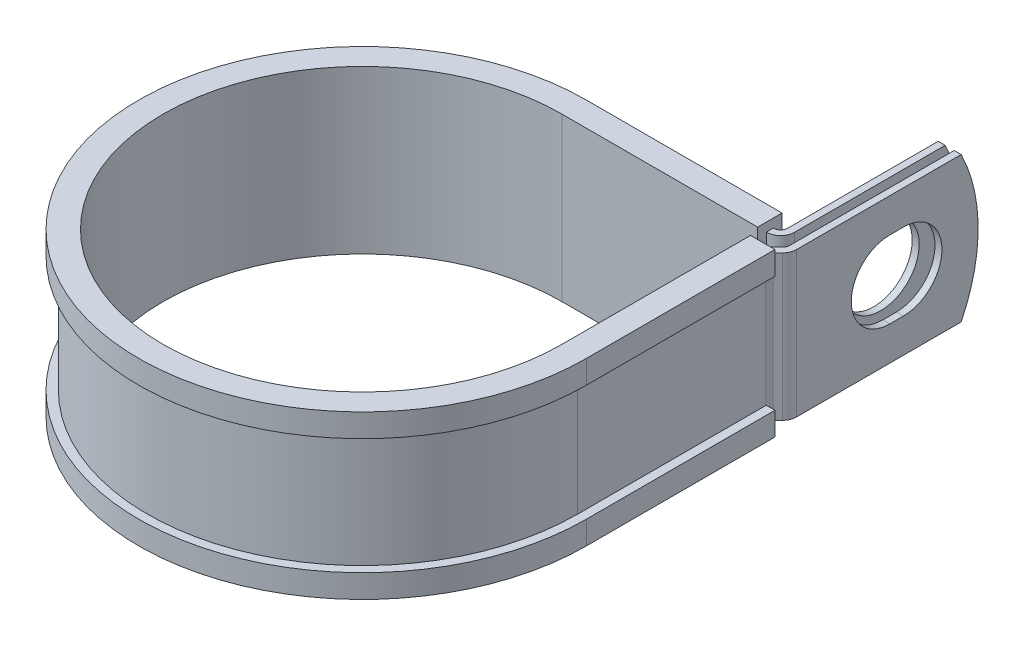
SolidWorks part; units mm, degrees
ref_plane "Front Plane" through (0, 0, 0) normal (0, 0, 1) x (1, 0, 0)
ref_plane "Top Plane" through (0, 0, 0) normal (0, 1, 0) x (1, 0, 0)
ref_plane "Right Plane" through (0, 0, 0) normal (1, 0, 0) x (0, 0, -1)
sketch "Sketch1" plane through (0, 0, 0) normal (0, 1, 0) x (1, 0, 0)
  line L0 (0, 36.449) -> (34.3333, 36.449)
  line L1 (36.449, 0) -> (36.449, 33.0365)
  line L2 (36.7717, 68.2498) -> (36.7717, 38.8874)
  line L3 (37.1632, 34.7607) -> (37.9894, 35.5869)
  line L5 (38.3465, 36.449) -> (38.3465, 68.2498)
  arc A0 (0, 36.449) -> (36.449, 0) centre (0, 0) ccw
  arc A1 (37.1632, 34.7607) -> (36.449, 33.0365) centre (38.8874, 33.0365) ccw
  arc A2 (37.9894, 35.5869) -> (38.3465, 36.449) centre (37.1273, 36.449) ccw
  arc A3 (34.3333, 36.449) -> (36.7717, 38.8874) centre (34.3333, 38.8874) ccw
extrude "Extrude-Thin1" add sketch "Sketch1" along normal mid plane 25.4 thin
sketch "Sketch2" plane through (35.5525, 0, 0) normal (-1, 0, 0) x (0, 0, 1)
  line L0 (-68.2498, 12.7) -> (-68.2498, -12.7) construction
  line L1 (0, 12.7) -> (0, -12.7) construction
  circle A0 centre (-53.975, 0) radius 6.7437
  point P2 (-68.2498, 0)
extrude "Cut-Extrude1" cut sketch "Sketch2" against normal up to surface (1.2192 mm away)
sketch "Sketch3" plane through (39.5657, 0, 0) normal (1, 0, 0) x (0, 0, -1)
  line L0 (52.7812, 0) -> (55.1688, 0) construction
  line L1 (52.7812, 6.7437) -> (55.1688, 6.7437)
  line L2 (52.7812, -6.7437) -> (55.1688, -6.7437)
  line L3 (68.2498, 12.7) -> (68.2498, -12.7) construction
  arc A0 (52.7812, 6.7437) -> (52.7812, -6.7437) centre (52.7812, 0) ccw
  arc A1 (55.1688, -6.7437) -> (55.1688, 6.7437) centre (55.1688, 0) ccw
  point P3 (53.975, 0)
  point P8 (68.2498, 0)
  point P11 (46.0375, 0)
  point P12 (61.9125, 0)
extrude "Cut-Extrude2" cut sketch "Sketch3" against normal up to surface (1.2192 mm away)
sketch "Sketch4" plane through (35.5525, 0, 0) normal (-1, 0, 0) x (0, 0, 1)
  line L0 (-68.2498, 12.7) -> (-68.2498, -12.7)
  line L1 (-68.2498, 12.7) -> (-65.2725, 12.7)
  line L2 (-68.2498, 12.7) -> (-38.8874, 12.7) construction
  line L3 (-68.2498, -12.7) -> (-65.2725, -12.7)
  line L4 (-68.2498, -12.7) -> (-38.8874, -12.7) construction
  arc A0 (-65.2725, 12.7) -> (-65.2725, -12.7) centre (-39.6748, 0) ccw
extrude "Cut-Extrude3" cut sketch "Sketch4" against normal through all contours A0 M4 M5 | A0 L0 M2
ref_plane "Plane1" through (0, 0, -33.0365) normal (0, 0, -1) x (-1, 0, 0)
ref_plane "Plane2" through (34.2825, 0, 0) normal (-1, 0, 0) x (0, 0, 1)
sketch "Sketch5" plane through (0, 0, -33.0365) normal (0, 0, -1) x (-1, 0, 0)
  line L0 (-37.6682, 12.7) -> (-36.449, 12.7)
  line L1 (-37.6682, 12.7) -> (-37.6682, -12.7) construction
  line L3 (-36.449, 12.7) -> (-36.449, -12.7)
  line L4 (-36.449, -12.7) -> (-37.6682, -12.7)
  line L5 (-37.6682, -12.7) -> (-37.6682, -10.16)
  line L6 (-37.6682, 12.7) -> (-37.6682, 10.16)
  line L7 (-39.1922, 14.224) -> (-39.1922, 10.16)
  line L8 (-39.1922, 14.224) -> (-34.925, 14.224)
  line L9 (-34.925, 14.224) -> (-34.925, -14.224)
  line L10 (-34.925, -14.224) -> (-39.1922, -14.224)
  line L11 (-39.1922, -14.224) -> (-39.1922, -10.16)
  line L12 (-39.1922, 10.16) -> (-37.6682, 10.16)
  line L13 (-37.6682, -10.16) -> (-39.1922, -10.16)
sketch "Sketch6" plane through (0, 12.7, 0) normal (0, 1, 0) x (1, 0, 0)
  line L0 (34.925, 0) -> (34.925, 33.0365)
  line L1 (34.925, 33.0365) -> (39.1922, 33.0365) construction
  line L2 (34.2825, 6.9878) -> (34.2825, -6.9878) construction
  line L5 (0, 34.925) -> (34.2825, 34.925)
  arc A0 (0, 34.925) -> (34.925, 0) centre (0, 0) ccw
sweep "Sweep1" add profiles "Sketch5" path "Sketch6"
equation "\"D4@Sketch5\" = \"D1@Extrude-Thin1\""
equation "\"D5@Sketch5\" = \"D5@Extrude-Thin1\""
equation "\"D1@Sketch3\" = \"D2@Sketch2\""
equation "\"D7@Sketch1\" = \"D3@Sketch2\" + \"D1@Sketch3\""
equation "\"D1@Sketch1\" = \"D1@Sketch6\" + 2 * \"D3@Sketch5\""
equation "\"D1@Sketch4\" = ( \"D1@Extrude-Thin1\" + .125 ) * 2"
equation "\"D9@Sketch1\"= \"D5@Extrude-Thin1\""
equation "\"D8@Sketch1\"= 2 * \"D5@Extrude-Thin1\""
equation "\"D2@Sketch1\" = 2 * \"D5@Extrude-Thin1\""
equation "\"D2@Sketch3\" = \"D1@Sketch2\""
